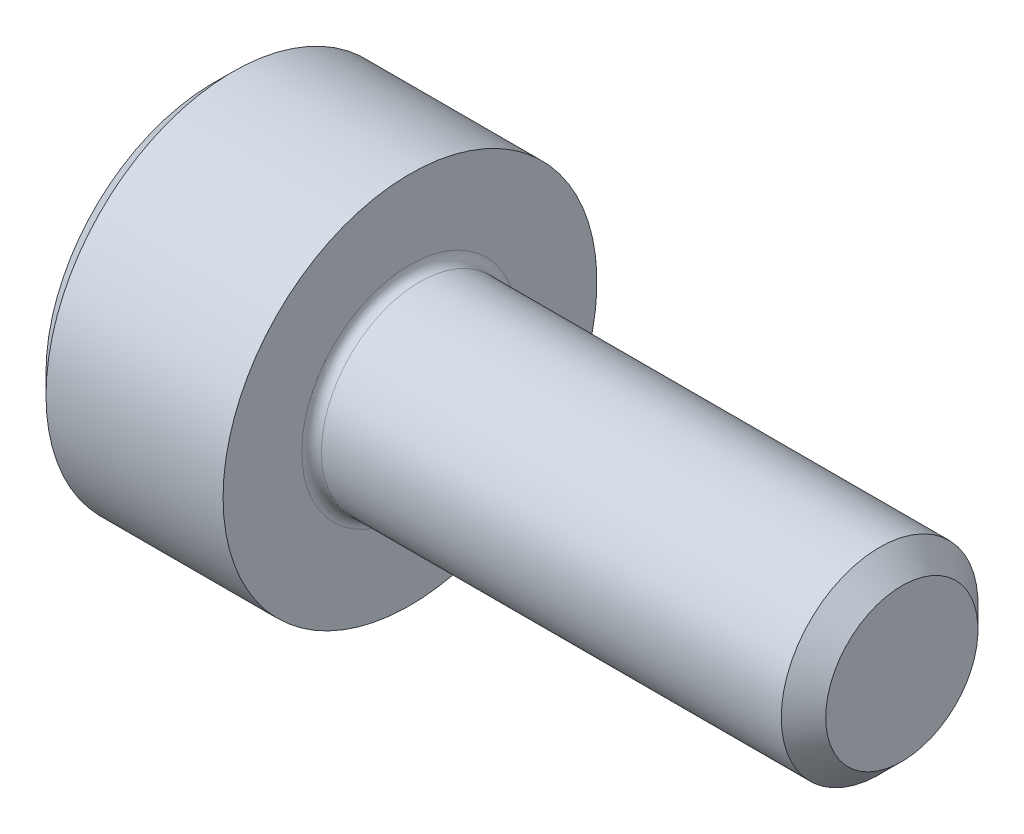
SolidWorks part; units mm, degrees
ref_plane "Plane1" through (0, 0, 0) normal (0, 0, 1) x (1, 0, 0)
ref_plane "Plane2" through (0, 0, 0) normal (0, 1, 0) x (1, 0, 0)
ref_plane "Plane3" through (0, 0, 0) normal (1, 0, 0) x (0, 0, -1)
sketch "BodySke" plane through (0, 0, 0) normal (0, 0, 1) x (1, 0, 0)
  line L0 (0, 0) -> (0, 1.7)
  line L1 (0.2, 1.9) -> (2, 1.9)
  line L2 (2, 1.9) -> (2, 1)
  line L3 (2, 1) -> (6.774, 1)
  line L4 (7, 0.774) -> (7, 0)
  line L5 (7, 0) -> (0, 0)
  line L6 (-31.75, 0) -> (127, 0) construction
  line L7 (0, 1.7) -> (0.2, 1.9)
  line L8 (7, 0.774) -> (6.774, 1)
  line L9 (0, -1.7) -> (0.2, -1.9) construction
  line L10 (7, -0.774) -> (6.774, -1) construction
  line L11 (2.4, 9.525) -> (2.4, 3.175) construction
  line L12 (2, 9.525) -> (2, 3.175) construction
  line L13 (-43, 9.525) -> (-43, 3.175) construction
  dimension "Diameter" = 2
  dimension "Head_ht" = 2
  dimension "Length" = 5
  dimension "Body_ch_ang" = 45
  dimension "Head_dia" = 3.8
  dimension "Head_ch_ang" = 45
  dimension "Minor_dia" = 1.548
  dimension "Advance" = 0.4
  dimension "Thread_nom" = 5
  dimension "Thread_length" = 50
  dimension "Head_ch_ht" = 0.2
revolve "Base-Revolve" add sketch "BodySke"
fillet "Fillet1" radius 0.1 1 edges at (2, 0, 1)
sketch "Sketch2" plane through (0, 0, 0) normal (0, 0, 1) x (1, 0, 0)
  line L0 (0, 0.7725) -> (1, 0.7725)
  line L1 (1, 0.7725) -> (1.446, 0)
  line L2 (-31.75, 0) -> (127, 0) construction
  line L3 (1.446, 0) -> (0, 0)
  line L4 (0, 0) -> (0, 0.7725)
  line L5 (0, 1.7) -> (0, -1.7) construction
  line L6 (0, 0) -> (47.625, 0) construction
  line L7 (2, -1.9) -> (2, 1.9) construction
  dimension "D1" = 0.7725
  dimension "D2" = 60
  dimension "Wall_thickness" = 1
revolve "Hex-PreBroach" cut sketch "Sketch2" angle 360 about L6
sketch "Sketch3" plane through (0, 0, 0) normal (-1, 0, 0) x (0, 0.5, 0.866)
  line L0 (0.446, 0.7725) -> (-0.446, 0.7725)
  line L1 (-0.446, 0.7725) -> (-0.892, 0)
  line L2 (0.446, 0.7725) -> (0.892, 0)
  line L3 (0.446, -0.7725) -> (0.892, 0)
  line L4 (0.446, -0.7725) -> (-0.446, -0.7725)
  line L5 (-0.446, -0.7725) -> (-0.892, 0)
  dimension "D1" = 0.7725
  dimension "D2" = 0.7725
  dimension "Hex_size" = 1.545
extrude "Hex" cut sketch "Sketch3" against normal blind 1
sketch "Sketch4" plane through (0, 0, 0) normal (-1, 0, 0) x (0, 0, 1)
  line L0 (0, 0) -> (0.9398, 0)
  line L1 (0, 0) -> (6.1484, 3.5498) construction
  line L2 (0, 0) -> (0.4699, 0.8139)
  line L3 (0.7832, 0.2175) -> (0.8962, 0.2828)
  line L4 (0.58, 0.5695) -> (0.693, 0.6348)
  arc A0 (0.7832, 0.2175) -> (0.58, 0.5695) centre (0, 0) ccw
  arc A1 (0.9398, 0) -> (0.8962, 0.2828) centre (0, 0) ccw
  arc A2 (0.4699, 0.8139) -> (0.693, 0.6348) centre (0, 0) cw
  dimension "D1" = 30
  dimension "Spline_n_dim" = 1.6256
  dimension "Spline_m_dim" = 1.8796
  dimension "D2" = 60
  dimension "D3" = 0.2032
  dimension "Spline_p_dim" = 0.4064
extrude "Spline" [suppressed] cut sketch "Sketch4" against normal blind 1
pattern_circular "CirPattern1" [suppressed] count 6 every 60
sketch "Sketch5" plane through (0, 0, 0) normal (0, 0, 1) x (1, 0, 0)
  line L0 (-31.75, 0) -> (127, 0) construction
  line L2 (0, 1.7) -> (0, -1.7) construction
  circle A0 centre (0.1, 0) radius 0.005
  dimension "Drilled_hole_dia" = 0.01
  dimension "Drilled_hole_loc" = 0.1
extrude "Hole" [suppressed] cut sketch "Sketch5" against normal through all and the other way through all
pattern_circular "Drilled-4" [suppressed] count 2 every 60
pattern_circular "Drilled-6" [suppressed] count 3 every 60
sketch "ThdSchSke" plane through (0, 0, 0) normal (0, 0, 1) x (1, 0, 0)
  line L0 (2.4, -0.774) -> (2.2418, -1)
  line L1 (2.4, -0.774) -> (2.5582, -1)
  line L2 (2.5582, -1) -> (2.5582, -1.25)
  line L3 (-3.175, 0) -> (5.1513, 0) construction
  line L5 (2.5582, -1.25) -> (2.2418, -1.25)
  line L6 (2.2418, -1.25) -> (2.2418, -1)
  line L7 (0, 1.7) -> (0, -1.7) construction
  dimension "Thread_minor" = 1.548
  dimension "Diameter" = 2
  dimension "Start" = 2.4
  dimension "SideAngle" = 55
  dimension "VeeAngle" = 70
  dimension "Overcut" = 2.5
revolve "ThreadSchematic" [suppressed] cut sketch "ThdSchSke" angle 360 about L3
pattern_linear "ThdSchPat" [suppressed]
equation "\"D2@Sketch3\" = \"Hex_size@Sketch3\" / 2"
equation "\"D1@Sketch3\" = \"Hex_size@Sketch3\" / 2"
equation "\"D1@Sketch2\" = \"Hex_size@Sketch3\" / 2"
equation "\"D3@Sketch4\" = \"Spline_p_dim@Sketch4\" / 2"
equation "\"Thread_minor@ThreadCosmetic\"  =  \"Minor_dia@BodySke\""
equation "\"D2@CirPattern1\" = 360 / \"Num_teeth@CirPattern1\""
equation "\"Wall_thickness@Sketch2\" = \"Head_ht@BodySke\" - \"Key_eng@Hex\""
equation "\"Thread_length@ThreadCosmetic\" = ((sgn( (\"Length@BodySke\" - \"Advance@BodySke\" ) - \"Thread_nom@BodySke\" )-1)*( (\"Length@BodySke\" - \"Advance@BodySke\" ) - \"Thread_nom@BodySke\" ))/-2+ \"Thread_nom@BodySke\""
equation "\"Thread_minor@ThdSchSke\" = \"Minor_dia@BodySke\""
equation "\"Diameter@ThdSchSke\" = \"Diameter@BodySke\""
equation "\"Overcut@ThdSchSke\" = \"Diameter@BodySke\" * 1.25"
equation "\"Start@ThdSchSke\" = \"Head_ht@BodySke\" + \"Length@BodySke\" - \"Thread_length@ThreadCosmetic\"  '---Non-countersunk---"
equation "\"Num_threads@ThdSchPat\" = int( \"Thread_length@ThreadCosmetic\" / \"Advance@BodySke\" + 0.999 )  + 1"
equation "\"Advance@ThdSchPat\" = \"Thread_length@ThreadCosmetic\" /  (\"Num_threads@ThdSchPat\" - 1) 'relax it"
equation "\"Num_threads@ThdSchPat\" = \"Num_threads@ThdSchPat\" - sgn( \"Num_threads@ThdSchPat\" - 1) '---chamfered tips only---"
